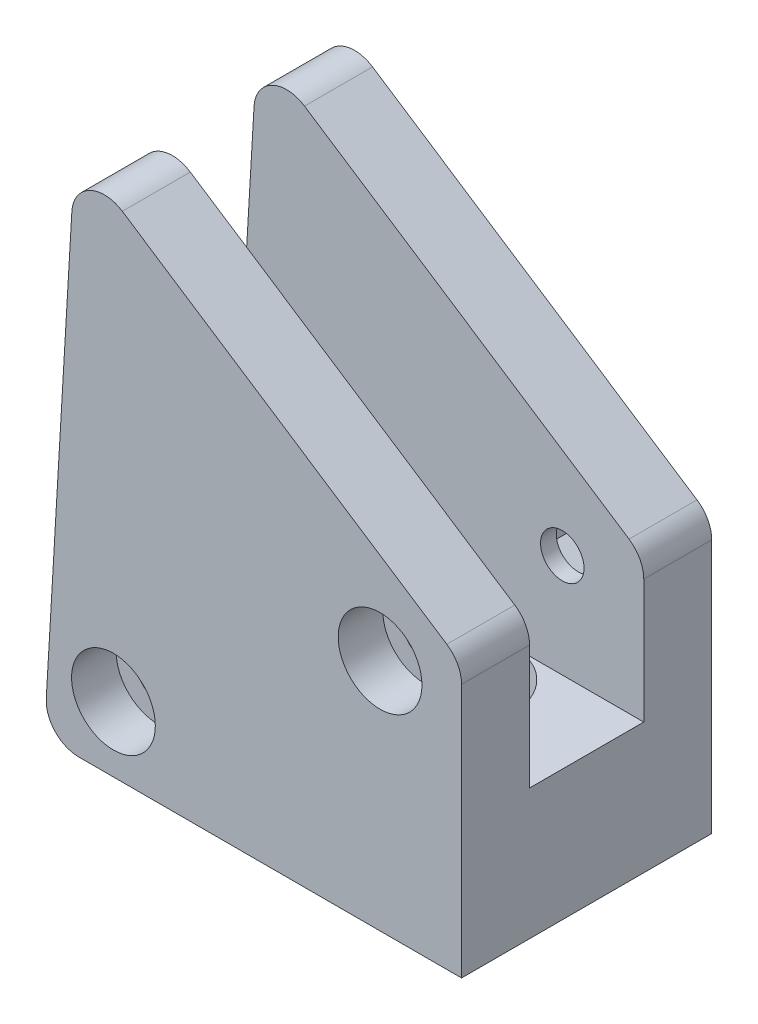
SolidWorks part; units mm, degrees
ref_plane "Plan de face" through (0, 0, 0) normal (0, 0, 1) x (1, 0, 0)
ref_plane "Plan de dessus" through (0, 0, 0) normal (0, 1, 0) x (1, 0, 0)
ref_plane "Plan de droite" through (0, 0, 0) normal (1, 0, 0) x (0, 0, -1)
sketch "Esquisse1" plane through (0, 0, 0) normal (0, 0, 1) x (1, 0, 0)
  line L0 (0, 0) -> (0, 23.3795)
  line L1 (-1.3552, 25.8884) -> (-31.184, 45.4437)
  line L2 (-35.8236, 43.1113) -> (-38.1768, 3.1765)
  line L3 (-35.182, 0) -> (0, 0)
  circle A0 centre (-32, 6) radius 2
  circle A1 centre (-7.4898, 21.5) radius 2
  circle A2 centre (-32, 40) radius 1.9711 construction
  arc A3 (-31.184, 45.4437) -> (-35.8236, 43.1113) centre (-32.8288, 42.9348) ccw
  arc A4 (0, 23.3795) -> (-1.3552, 25.8884) centre (-3, 23.3795) ccw
  arc A5 (-38.1768, 3.1765) -> (-35.182, 0) centre (-35.182, 3) ccw
  point P9 (0, 0)
  point P10 (-35.5652, 47.7882)
  point P17 (0, 25)
  point P20 (-32, 40)
  point P21 (-35.4518, 42.7218)
  dimension "D1" = 4
  dimension "D8" = 3
  dimension "D9" = 3
  dimension "D2" = 32
  dimension "D3" = 6
  dimension "D4" = 21.5
  dimension "D5" = 29
  dimension "D6" = 25
  dimension "D7" = 40
  dimension "D10" = 4
  dimension "D11" = 5
  dimension "D12" = 6
extrude "Boss.-Extru.1" add sketch "Esquisse1" along normal mid plane 23
sketch "Esquisse2" plane through (0, 0, 0) normal (0, 0, 1) x (1, 0, 0)
  line L1 (0, 0) -> (-24, 0)
  line L2 (0, 0) -> (0, 12)
  line L3 (0, 12) -> (-21, 12)
  line L4 (-24, 0) -> (-24, 9)
  arc A0 (-21, 12) -> (-24, 9) centre (-21, 9) ccw
  dimension "D3" = 3
  dimension "D1" = 12
  dimension "D2" = 24
extrude "Enlèv. mat.-Extru.1" cut sketch "Esquisse2" against normal mid plane 10.5 flip side to cut
sketch "Esquisse3" plane through (0, 0, 0) normal (0, -1, 0) x (1, 0, 0)
  line L0 (0, 0) -> (-24, 0) construction
  line L1 (-24, -5.25) -> (-24, 5.25) construction
  line L2 (0, 11.5) -> (0, -11.5) construction
  circle A0 centre (-12, 0) radius 5.25
  dimension "D1" = 10.5
  dimension "D2" = 12
extrude "Enlèv. mat.-Extru.2" cut sketch "Esquisse3" against normal through all
sketch "Esquisse4" plane through (0, 0, 11.5) normal (0, 0, 1) x (1, 0, 0)
  circle A0 centre (-32, 6) radius 3.85
  circle A1 centre (-7.4898, 21.5) radius 3.85
  dimension "D1" = 7.7
extrude "Enlèv. mat.-Extru.3" cut sketch "Esquisse4" against normal blind 4.1
sketch "Esquisse5" plane through (0, 0, -11.5) normal (0, 0, -1) x (-1, 0, 0)
  line L1 (7.5096, 25.8878) -> (3.6997, 23.7111)
  line L2 (3.6997, 23.7111) -> (3.6799, 19.3232)
  line L3 (3.6799, 19.3232) -> (7.47, 17.1122)
  line L4 (7.47, 17.1122) -> (11.2799, 19.2889)
  line L5 (11.2799, 19.2889) -> (11.2997, 23.6768)
  line L6 (11.2997, 23.6768) -> (7.5096, 25.8878)
  line L7 (32, 10.3879) -> (28.2, 8.1939)
  line L8 (28.2, 8.1939) -> (28.2, 3.8061)
  line L9 (28.2, 3.8061) -> (32, 1.6121)
  line L10 (32, 1.6121) -> (35.8, 3.8061)
  line L11 (35.8, 3.8061) -> (35.8, 8.1939)
  line L12 (35.8, 8.1939) -> (32, 10.3879)
  circle A0 centre (7.4898, 21.5) radius 3.8 construction
  circle A1 centre (32, 6) radius 3.8 construction
  dimension "D1" = 7.6
extrude "Enlèv. mat.-Extru.4" cut sketch "Esquisse5" against normal blind 4.8
